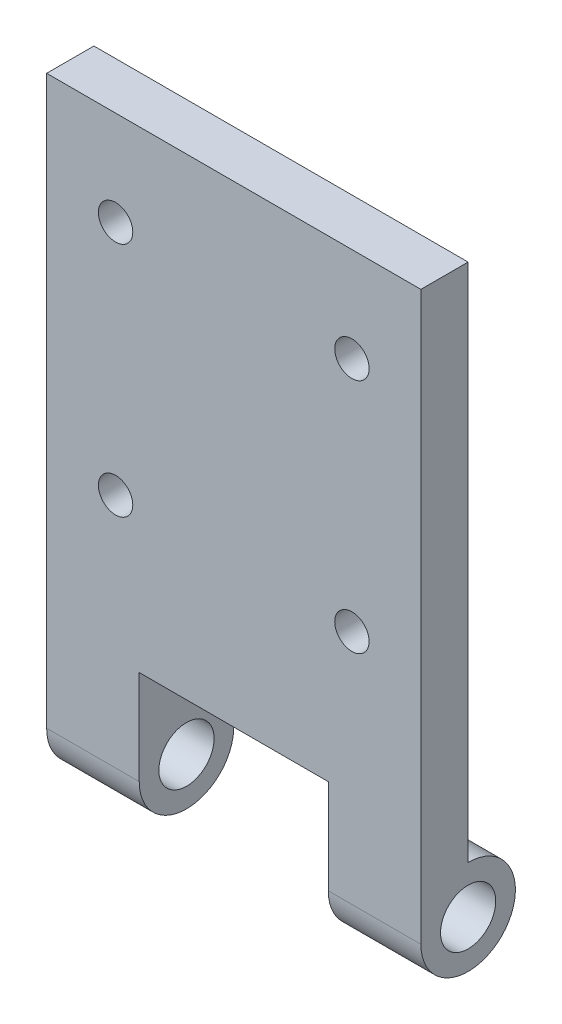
SolidWorks part; units mm, degrees
ref_plane "Plan de face" through (0, 0, 0) normal (0, 0, 1) x (1, 0, 0)
ref_plane "Plan de dessus" through (0, 0, 0) normal (0, 1, 0) x (1, 0, 0)
ref_plane "Plan de droite" through (0, 0, 0) normal (1, 0, 0) x (0, 0, -1)
sketch "Esquisse1" plane through (0, 0, 0) normal (0, 0, 1) x (1, 0, 0)
  line L0 (39.5881, 120) -> (39.5881, 0) construction
  line L1 (0, 0) -> (79.1762, 0)
  line L2 (0, 0) -> (0, 120)
  line L3 (0, 120) -> (79.1762, 120)
  line L4 (79.1762, 0) -> (79.1762, 120)
  line L5 (14.5881, 50) -> (67.8969, 50) construction
  line L6 (14.5881, 100) -> (67.8969, 100) construction
  circle A0 centre (14.5881, 50) radius 3.6356
  circle A1 centre (14.5881, 100) radius 3.6356
  circle A2 centre (64.5881, 100) radius 3.6356
  circle A3 centre (64.5881, 50) radius 3.6356
  dimension "D1" = 50
  dimension "D3" = 25
  dimension "D2" = 25
  dimension "D4" = 50
  dimension "D5" = 120
extrude "Boss.-Extru.1" add sketch "Esquisse1" along normal blind 10
sketch "Esquisse2" plane through (79.1762, 0, 0) normal (1, 0, 0) x (0, 0, -1)
  circle A0 centre (0, 0) radius 10
  dimension "D1" = 20
extrude "Boss.-Extru.2" add sketch "Esquisse2" against normal up to surface (79.1762 mm away)
sketch "Esquisse3" plane through (79.1762, 0, 0) normal (1, 0, 0) x (0, 0, -1)
  circle A0 centre (0, 0) radius 5.8449
extrude "Enlèv. mat.-Extru.1" cut sketch "Esquisse3" against normal through all
sketch "Esquisse4" plane through (0, 0, 10) normal (0, 0, 1) x (1, 0, 0)
  line L0 (39.5881, -10) -> (39.5881, 34.5502) construction
  line L1 (0, -10) -> (79.1762, -10) construction
  line L2 (19.5881, -13.8181) -> (19.5881, 20)
  line L3 (19.5881, 20) -> (59.5881, 20)
  line L4 (19.5881, -13.8181) -> (59.5881, -13.8181)
  line L5 (59.5881, -13.8181) -> (59.5881, 20)
  point P9 (39.5881, 20)
  point P10 (39.5881, -13.8181)
  dimension "D1" = 20
  dimension "D2" = 30
extrude "Enlèv. mat.-Extru.2" cut sketch "Esquisse4" against normal blind 30
